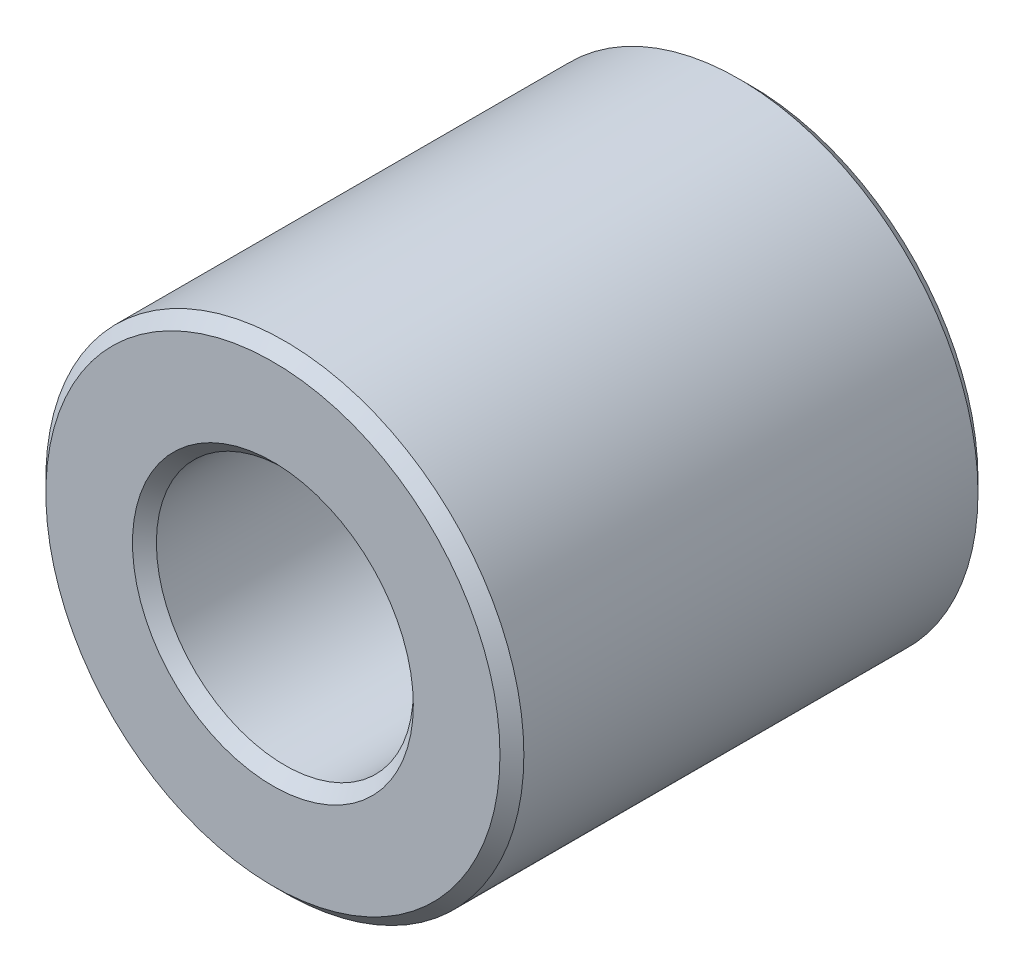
SolidWorks part; units mm, degrees
ref_plane "Front Plane" through (0, 0, 0) normal (0, 0, 1) x (1, 0, 0)
ref_plane "Top Plane" through (0, 0, 0) normal (0, 1, 0) x (1, 0, 0)
ref_plane "Right Plane" through (0, 0, 0) normal (1, 0, 0) x (0, 0, -1)
sketch "Sketch1" plane through (0, 0, 0) normal (0, 0, 1) x (1, 0, 0)
  circle A0 centre (0, 0) radius 4
  circle A1 centre (0, 0) radius 2.15
  dimension "D1" = 8
  dimension "D2" = 4.3
extrude "Boss-Extrude2" add sketch "Sketch1" along normal mid plane 8
chamfer "Chamfer3" distance 0.2 angle 45 4 edges at (4, 0, 4) (4, 0, -4) (2.15, 0, -4) (2.15, 0, 4)
